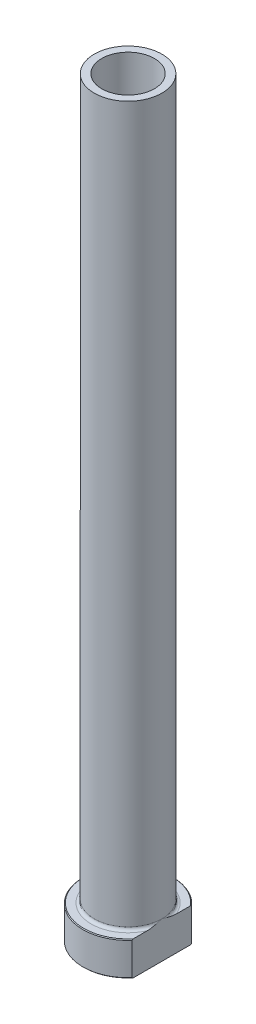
SolidWorks part; units mm, degrees
ref_plane "Front Plane" through (0, 0, 0) normal (0, 0, 1) x (1, 0, 0)
ref_plane "Top Plane" through (0, 0, 0) normal (0, 1, 0) x (1, 0, 0)
ref_plane "Right Plane" through (0, 0, 0) normal (1, 0, 0) x (0, 0, -1)
sketch "Sketch1" plane through (0, 0, 0) normal (0, 0, 1) x (1, 0, 0)
  line L0 (-7, 200) -> (-9, 200)
  line L1 (-9, 200) -> (-9, 9)
  line L2 (-9, 9) -> (-12, 9)
  line L3 (-12, 9) -> (-12, 0)
  line L4 (11.55, 0) -> (-11.55, 0) construction
  line L5 (-12, 0) -> (-7.25, 0)
  line L6 (-7, 145) -> (-7, 200)
  line L7 (0, 92.1877) -> (0, -15.5353) construction
  line L8 (0, -13.2) -> (0, 13.2) construction
  line L9 (-7, 145) -> (-7.25, 133)
  line L10 (-7.25, 133) -> (-7.25, 0)
  dimension "D1" = 0.25
  dimension "ID" = 14
  dimension "OD" = 18
  dimension "L" = 200
  dimension "H" = 24
  dimension "T" = 9
  dimension "N" = 55
  dimension "D2" = 12
  dimension "L-N" = 145
revolve "Revolve1" add sketch "Sketch1" angle 360 about L7
fillet "Fillet1" radius 0.8 1 edges at (0, 9, 9)
chamfer "Chamfer1" distance 0.2 angle 45 2 edges at (0, 9, 12) (0, 0, 12)
sketch "Sketch2" plane through (0, 0, 0) normal (0, -1, 0) x (1, 0, 0)
  line L0 (9, 7.9373) -> (9, -7.9373)
  circle A0 centre (0, 0) radius 12 construction
  arc A1 (9, 7.9373) -> (9, -7.9373) centre (0, 0) cw
  circle A2 centre (0, 0) radius 9 construction
extrude "Cut-Extrude1" cut sketch "Sketch2" against normal through all
chamfer "Chamfer2" distance 0.5 angle 45 1 edges at (0, 0, 7.25)
